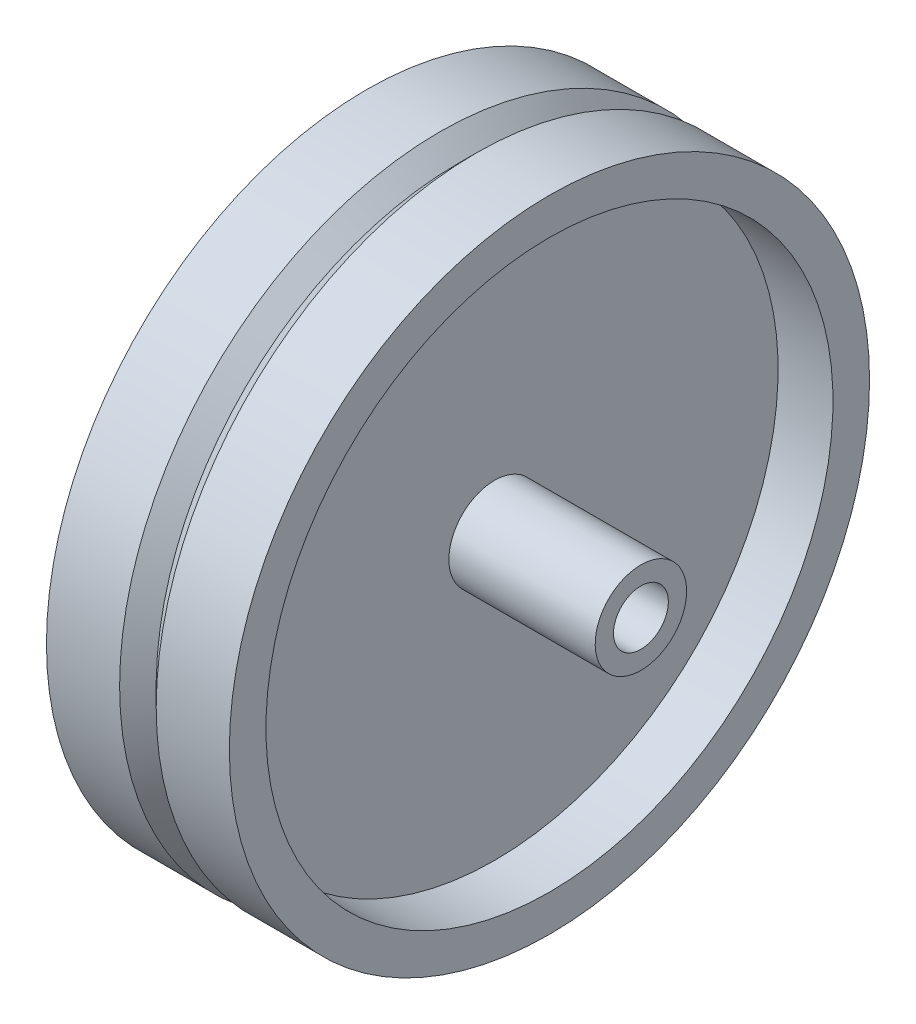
SolidWorks part; units mm, degrees
ref_plane "Front Plane" through (0, 0, 0) normal (0, 0, 1) x (1, 0, 0)
ref_plane "Top Plane" through (0, 0, 0) normal (0, 1, 0) x (1, 0, 0)
ref_plane "Right Plane" through (0, 0, 0) normal (1, 0, 0) x (0, 0, -1)
sketch "Sketch1" plane through (0, 0, 0) normal (0, 0, 1) x (1, 0, 0)
  line L0 (-1, 0) -> (-1, 2)
  line L5 (-1, 32) -> (7, 32)
  line L9 (19, 2) -> (29, 2)
  line L10 (29, 2) -> (29, 0)
  line L11 (29, 0) -> (-1, 0)
  line L12 (29, -3) -> (-23.6075, -3) construction
  line L19 (11, 32) -> (19, 32)
  line L20 (-1, 32) -> (-1, 28)
  line L21 (-1, 28) -> (5, 28)
  line L22 (5, 28) -> (5, 2)
  line L23 (5, 2) -> (-1, 2)
  line L24 (9, 0) -> (9, -1.0786) construction
  line L25 (13, 2) -> (19, 2)
  line L26 (13, 28) -> (13, 2)
  line L27 (19, 28) -> (13, 28)
  line L28 (19, 28) -> (19, 32)
  line L29 (7, 32) -> (9, 30)
  line L30 (9, 30) -> (11, 32)
  point P15 (10, 47)
  dimension "D1" = 20
  dimension "D2" = 3
  dimension "D3" = 35
  dimension "D4" = 30
  dimension "D5" = 4
  dimension "D7" = 5
revolve "Revolve1" add sketch "Sketch1" angle 360 about L12
